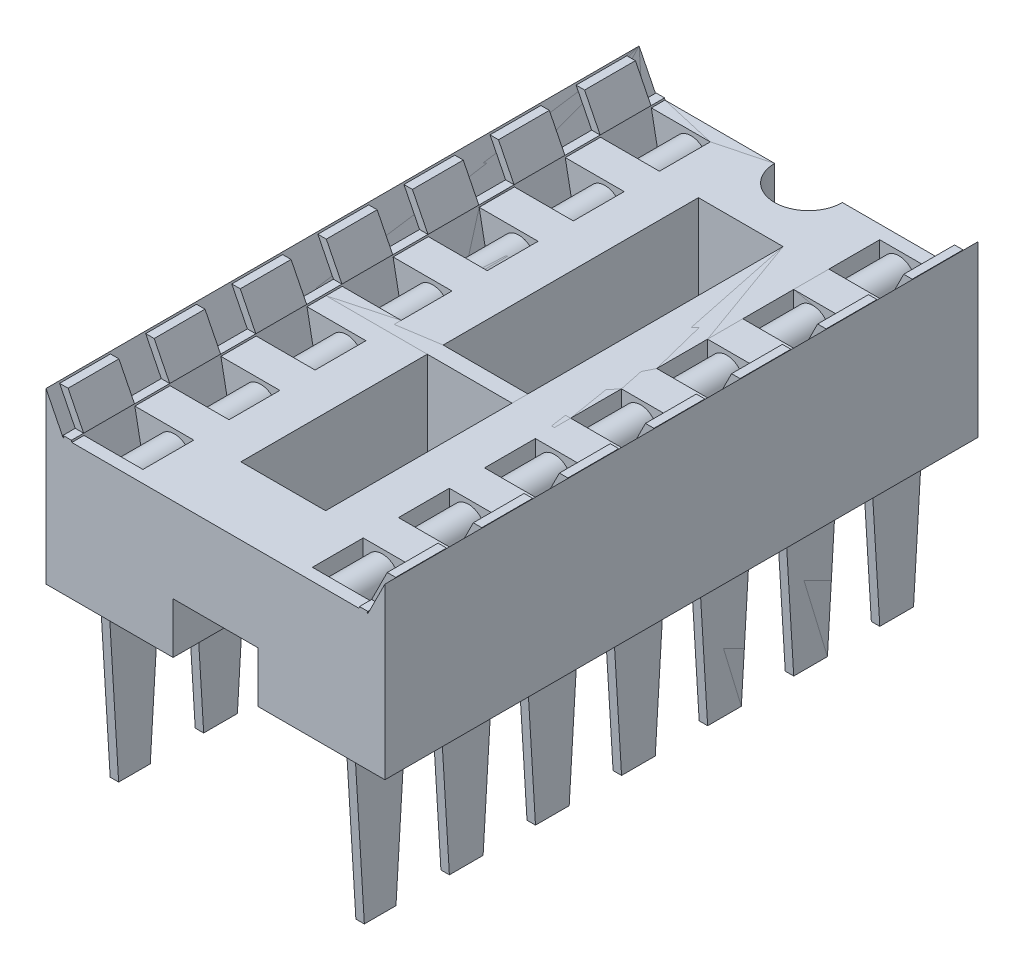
SolidWorks part; units mm, degrees
ref_plane "Plan1" through (0, 0, 0) normal (0, 0, 1) x (1, 0, 0)
ref_plane "Plan2" through (0, 0, 0) normal (0, 1, 0) x (1, 0, 0)
ref_plane "Plan3" through (0, 0, 0) normal (1, 0, 0) x (0, 0, -1)
imported_body "Importée1"
sketch "Esquisse1" plane through (0, 0, 17.5) normal (0, 0, 1) x (1, 0, 0)
  line L1 (-10, 10) -> (10, 10)
  line L2 (-10, 10) -> (-10, -10)
  line L3 (-10, -10) -> (10, -10)
  line L4 (10, 10) -> (10, -10)
extrude "Enlèv. mat.-Extru.1" cut sketch "Esquisse1" against normal blind 7.5
sketch "Esquisse2" plane through (1.25, 0, 0) normal (-1, 0, 0) x (0, 0, 1)
  line L1 (10, 4) -> (9.5315, 4)
  line L2 (10, 4) -> (10, 0)
  line L3 (10, 0) -> (9.5315, 0)
  line L4 (9.5315, 4) -> (9.5315, 0)
extrude "Boss.-Extru.1" add sketch "Esquisse2" along normal blind 3
